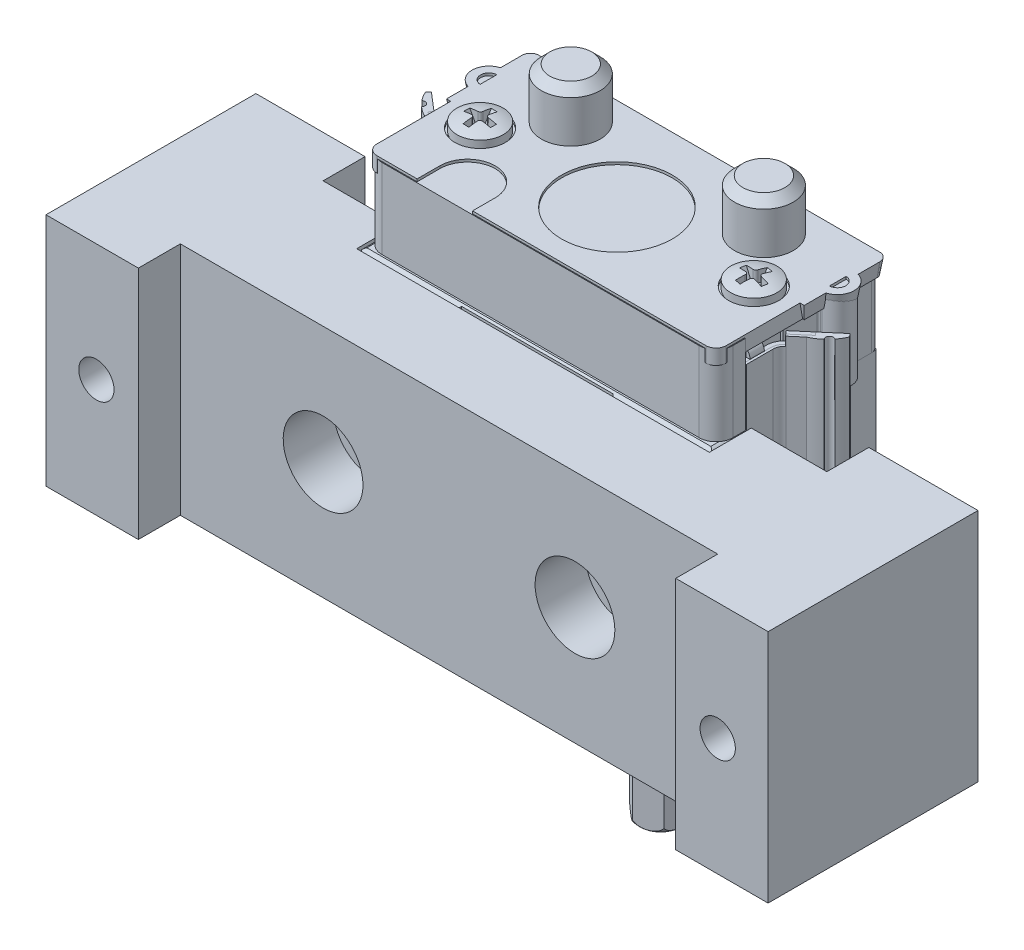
SolidWorks part; units mm, degrees
ref_plane "前视基准面" through (0, 0, 0) normal (0, 0, 1) x (1, 0, 0)
ref_plane "上视基准面" through (0, 0, 0) normal (0, 1, 0) x (1, 0, 0)
ref_plane "右视基准面" through (0, 0, 0) normal (1, 0, 0) x (0, 0, -1)
imported_body "KKU60C-S1-1-solid1"
imported_body "KKU60C-S1-1-solid2"
imported_body "KKU60C-S1-1-solid3"
imported_body "KKU60C-S1-1-solid4"
imported_body "KKU60C-S1-1-solid5"
imported_body "KKU60C-S1-1-solid6"
imported_body "KKU60C-S1-1-solid7"
imported_body "KKU60C-S1-1-solid8"
imported_body "KKU60C-S1-1-solid9"
imported_body "KKU60C-S1-1-solid10"
imported_body "KKU60C-S1-1-solid11"
imported_body "KKU60C-S1-1-solid12"
imported_body "KKU60C-S1-1-solid13"
imported_body "KKU60C-S1-1-solid14"
imported_body "KKU60C-S1-1-solid15"
imported_body "KKU60C-S1-1-solid16"
imported_body "KKU60C-S1-1-solid17"
imported_body "KKU60C-S1-1-solid18"
imported_body "KKU60C-S1-1-solid19"
imported_body "KKU60C-S1-C-1-solid1"
imported_body "油嘴-1-solid1"
sketch "草图1" plane through (-28.8153, 0, 0) normal (-1, 0, 0) x (0, 0, 1)
  line L0 (67.2, 27.6939) -> (67.2, 18.1939) construction
  line L1 (67.2, 25.4986) -> (65.7, 25.4986)
  line L2 (67.2, 25.4986) -> (67.2, 21.6105)
  line L3 (67.2, 21.6105) -> (65.7, 21.6105)
  line L4 (65.7, 25.4986) -> (65.7, 21.6105)
  line L5 (65.7, 27.6939) -> (65.7, 18.1939) construction
extrude "切除-拉伸1" cut sketch "草图1" along normal blind 10
sketch "草图2" plane through (12.9847, 0, 0) normal (1, 0, 0) x (0, 0, -1)
  line L0 (-67.2, -19.3061) -> (-67.2, -9.8061) construction
  line L1 (-67.2, -17.1863) -> (-65.7, -17.1863)
  line L2 (-67.2, -17.1863) -> (-67.2, -12.6194)
  line L3 (-67.2, -12.6194) -> (-65.7, -12.6194)
  line L4 (-65.7, -17.1863) -> (-65.7, -12.6194)
  line L5 (-65.7, -19.3061) -> (-65.7, -9.8061) construction
extrude "切除-拉伸2" cut sketch "草图2" along normal blind 10
